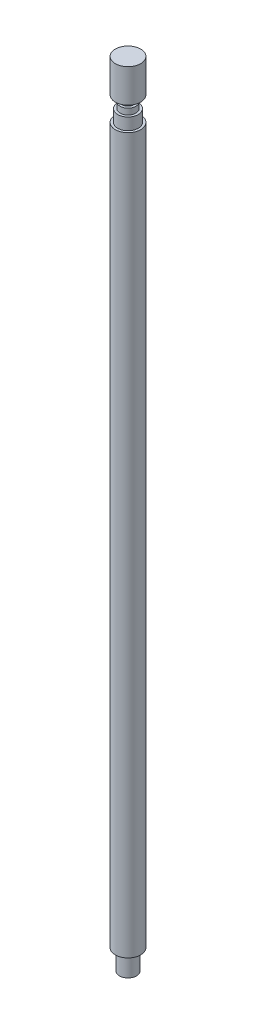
SolidWorks part; units mm, degrees
ref_plane "Plan de face" through (0, 0, 0) normal (0, 0, 1) x (1, 0, 0)
ref_plane "Plan de dessus" through (0, 0, 0) normal (0, 1, 0) x (1, 0, 0)
ref_plane "Plan de droite" through (0, 0, 0) normal (1, 0, 0) x (0, 0, -1)
sketch "Esquisse1" plane through (0, 0, 0) normal (0, 1, 0) x (1, 0, 0)
  circle A0 centre (0, 0) radius 2.125
  dimension "D1" = 4.25
extrude "Extrusion1" add sketch "Esquisse1" along normal blind 120
sketch "Esquisse2" plane through (0, 120, 0) normal (0, 1, 0) x (-1, 0, 0)
  circle A0 centre (0, 0) radius 1.725
  dimension "D1" = 3.45
extrude "Extrusion2" add sketch "Esquisse2" along normal blind 2
sketch "Esquisse3" plane through (0, 122, 0) normal (0, 1, 0) x (-1, 0, 0)
  circle A0 centre (0, 0) radius 1.325
  dimension "D1" = 2.65
extrude "Extrusion3" add sketch "Esquisse3" along normal blind 1
sketch "Esquisse4" plane through (0, 123, 0) normal (0, 1, 0) x (-1, 0, 0)
  circle A0 centre (0, 0) radius 0.925
  dimension "D1" = 1.85
extrude "Extrusion4" add sketch "Esquisse4" along normal blind 6.6
sketch "Esquisse5" plane through (0, 129.6, 0) normal (0, 1, 0) x (-1, 0, 0)
  circle A0 centre (0, 0) radius 2.125
  dimension "D1" = 4.25
extrude "Extrusion5" add sketch "Esquisse5" against normal blind 5.6
sketch "Esquisse6" plane through (0, 0, 0) normal (0, -1, 0) x (1, 0, 0)
  circle A0 centre (0, 0) radius 1.435
  dimension "D1" = 2.87
extrude "Extrusion6" add sketch "Esquisse6" along normal blind 3.4
